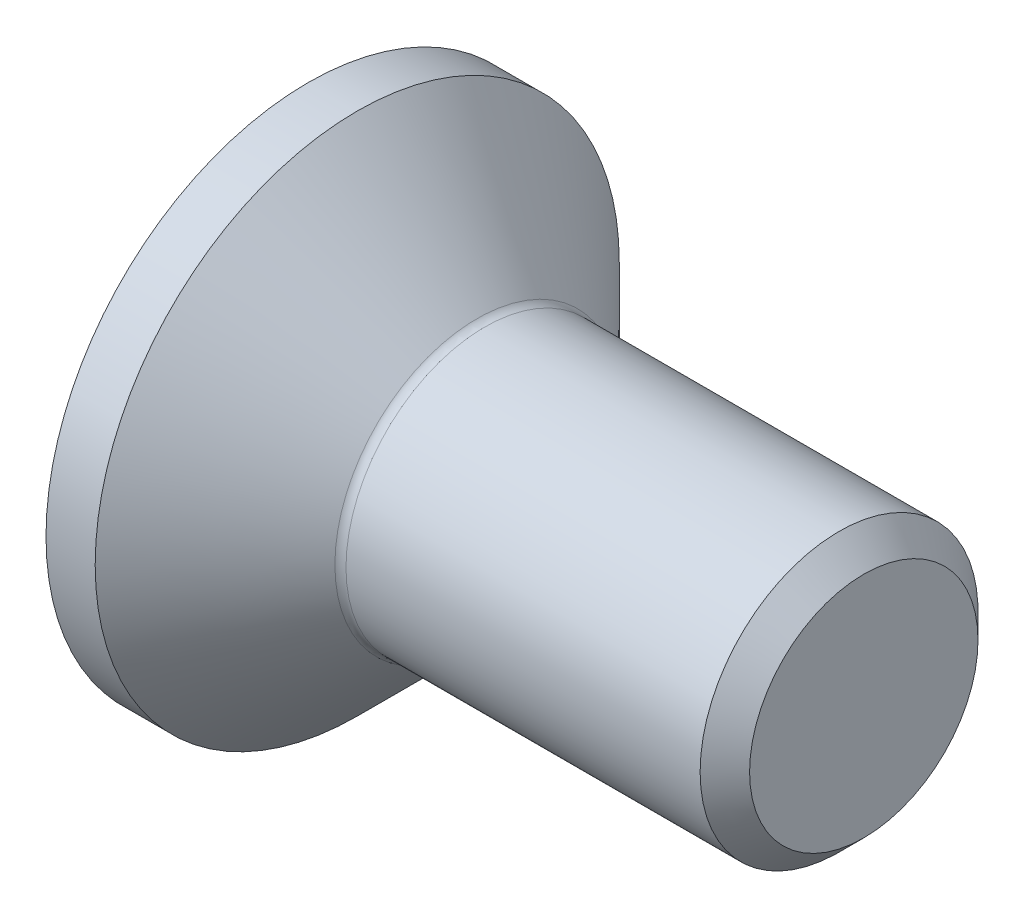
SolidWorks part; units mm, degrees
ref_plane "Plane1" through (0, 0, 0) normal (0, 0, 1) x (1, 0, 0)
ref_plane "Plane2" through (0, 0, 0) normal (0, 1, 0) x (1, 0, 0)
ref_plane "Plane3" through (0, 0, 0) normal (1, 0, 0) x (0, 0, -1)
sketch "BodySke" plane through (0, 0, 0) normal (0, 0, 1) x (1, 0, 0)
  line L0 (0, 0) -> (0, 4.715)
  line L1 (0.885, 4.715) -> (3.1, 2.5)
  line L2 (0, 4.715) -> (0.885, 4.715)
  line L3 (3.1, 2.5) -> (9.555, 2.5)
  line L4 (10, 2.055) -> (10, 0)
  line L5 (10, 0) -> (0, 0)
  line L6 (0, 0) -> (127, 0) construction
  line L7 (0.885, -4.715) -> (3.1, -2.5) construction
  line L8 (10, 2.055) -> (9.555, 2.5)
  line L9 (0, -4.715) -> (0.885, -4.715) construction
  line L10 (10, -2.055) -> (9.555, -2.5) construction
  line L11 (3.9, 8.85) -> (3.9, -13.375) construction
  line L12 (0, 19.05) -> (0, -3.175) construction
  dimension "D1" = 0.885
  dimension "Diameter" = 5
  dimension "Head_ht" = 3.1
  dimension "Length" = 10
  dimension "Body_ch_ang" = 45
  dimension "Head_dia" = 9.43
  dimension "Minor_dia" = 4.11
  dimension "Head_ang" = 90
  dimension "Advance" = 0.8
  dimension "Thread_nom" = 10
revolve "BaseBody" add sketch "BodySke"
fillet "Fillet1" radius 0.2 1 edges at (3.1, 0, 2.5)
sketch "Sketch2" plane through (0, 0, 0) normal (0, 0, 1) x (1, 0, 0)
  line L0 (0, 1.5) -> (1.9, 1.5)
  line L1 (1.9, 1.5) -> (2.766, 0)
  line L2 (0, 0) -> (127, 0) construction
  line L3 (2.766, 0) -> (0, 0)
  line L4 (0, 0) -> (0, 1.5)
  line L5 (0, -1.5) -> (1.9, -1.5) construction
  line L6 (0, 0) -> (47.625, 0) construction
  line L8 (0, 4.715) -> (0, -4.715) construction
  dimension "D2" = 60
  dimension "PreBroach_depth" = 1.9
  dimension "PreBroach_dia" = 3
revolve "PreBroach" cut sketch "Sketch2" angle 360 about L6
sketch "Sketch3" plane through (0, 0, 0) normal (-1, 0, 0) x (0, 0, 1)
  line L0 (-1.5, -0.866) -> (-1.5, 0.866)
  line L1 (-1.5, 0.866) -> (0, 1.7321)
  line L2 (0, 1.7321) -> (1.5, 0.866)
  line L3 (1.5, 0.866) -> (1.5, -0.866)
  line L4 (1.5, -0.866) -> (0, -1.7321)
  line L5 (0, -1.7321) -> (-1.5, -0.866)
  dimension "D1" = 1.5
  dimension "D2" = 1.5
  dimension "D3" = 3
  dimension "Hex_size" = 3
extrude "Hex" cut sketch "Sketch3" against normal blind 1.9
sketch "ThdSchSke" plane through (0, 0, 0) normal (0, 0, 1) x (1, 0, 0)
  line L0 (5.5, -2.055) -> (5.1884, -2.5)
  line L1 (5.5, -2.055) -> (5.8116, -2.5)
  line L2 (5.8116, -2.5) -> (5.8116, -3.125)
  line L3 (-3.175, 0) -> (5.1513, 0) construction
  line L4 (0, 4.715) -> (0, -4.715) construction
  line L5 (5.8116, -3.125) -> (5.1884, -3.125)
  line L6 (5.1884, -3.125) -> (5.1884, -2.5)
  dimension "Thread_minor" = 4.11
  dimension "Diameter" = 5
  dimension "Start" = 5.5
  dimension "SideAngle" = 55
  dimension "VeeAngle" = 70
  dimension "Overcut" = 6.25
revolve "ThreadSchematic" [suppressed] cut sketch "ThdSchSke" angle 360 about L3
pattern_linear "ThdSchPat" [suppressed]
equation "\"Thread_minor@ThreadCosmetic\"  =  \"Minor_dia@BodySke\""
equation "\"D1@Sketch3\" = \"Hex_size@Sketch3\" / 2"
equation "\"D2@Sketch3\" = \"D1@Sketch3\""
equation "\"D3@Sketch3\" = \"Hex_size@Sketch3\""
equation "\"Thread_length@ThreadCosmetic\" = ((sgn( (\"Length@BodySke\" - \"Advance@BodySke\" * 3.0 - \"Head_ht@BodySke\" ) - \"Thread_nom@BodySke\" )-1)*( (\"Length@BodySke\" - \"Advance@BodySke\" * 3.0 - \"Head_ht@BodySke\" "
equation "\"Thread_minor@ThdSchSke\" = \"Minor_dia@BodySke\""
equation "\"Diameter@ThdSchSke\" = \"Diameter@BodySke\""
equation "\"Overcut@ThdSchSke\" = \"Diameter@BodySke\" * 1.25"
equation "\"Start@ThdSchSke\" = 0.000001 + \"Length@BodySke\" - \"Thread_length@ThreadCosmetic\"  '---Countersunk---"
equation "\"Num_threads@ThdSchPat\" = int( \"Thread_length@ThreadCosmetic\" / \"Advance@BodySke\" + 0.999 )  + 1"
equation "\"Advance@ThdSchPat\" = \"Thread_length@ThreadCosmetic\" /  (\"Num_threads@ThdSchPat\" - 1) 'relax it"
equation "\"Num_threads@ThdSchPat\" = \"Num_threads@ThdSchPat\" - sgn( \"Num_threads@ThdSchPat\" - 1) '---chamfered tips only---"
